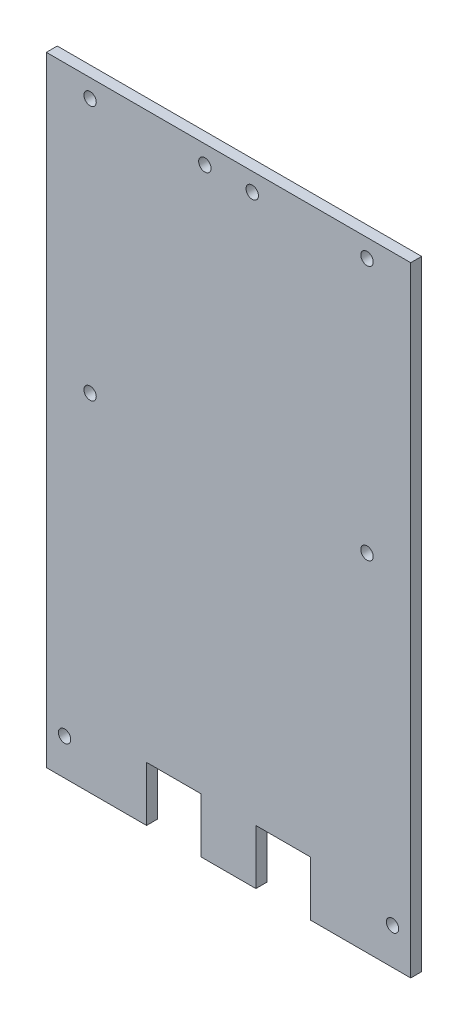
SolidWorks part; units mm, degrees
ref_plane "前视基准面" through (0, 0, 0) normal (0, 0, 1) x (1, 0, 0)
ref_plane "上视基准面" through (0, 0, 0) normal (0, 1, 0) x (1, 0, 0)
ref_plane "右视基准面" through (0, 0, 0) normal (1, 0, 0) x (0, 0, -1)
sketch "草图1" plane through (0, 0, 0) normal (0, 0, 1) x (1, 0, 0)
  line L1 (-50, 85) -> (50, 85)
  line L2 (-50, 85) -> (-50, -85)
  line L3 (-50, -85) -> (50, -85)
  line L4 (50, 85) -> (50, -85)
  line L5 (-50, 85) -> (50, -85) construction
  line L6 (-50, -85) -> (50, 85) construction
  point P0 (0, 0)
  dimension "D1" = 100
  dimension "D2" = 170
extrude "凸台-拉伸1" add sketch "草图1" along normal blind 3
sketch "草图2" plane through (0, 0, 3) normal (0, 0, 1) x (1, 0, 0)
  line L0 (-50, -85) -> (50, -85) construction
  line L1 (-22.5, -100) -> (-7.5, -100)
  line L2 (-22.5, -100) -> (-22.5, -70)
  line L3 (-22.5, -70) -> (-7.5, -70)
  line L4 (-7.5, -100) -> (-7.5, -70)
  line L5 (-22.5, -100) -> (-7.5, -70) construction
  line L6 (-22.5, -70) -> (-7.5, -100) construction
  line L8 (7.5, -100) -> (22.5, -100)
  line L9 (7.5, -100) -> (7.5, -70)
  line L10 (7.5, -70) -> (22.5, -70)
  line L11 (22.5, -100) -> (22.5, -70)
  line L12 (7.5, -100) -> (22.5, -70) construction
  line L13 (7.5, -70) -> (22.5, -100) construction
  point P0 (-15, -85)
  point P7 (15, -85)
  point P12 (0, -85)
  dimension "D1" = 15
  dimension "D2" = 15
  dimension "D3" = 15
  dimension "D4" = 7.5
  dimension "D5" = 30
  dimension "D6" = 30
extrude "切除-拉伸1" cut sketch "草图2" against normal blind 3
hole_wizard "Ø3.4 (3.4) 直径孔1" positions "草图3" profile "草图4" hole size "Ø3.4" standard "GB"
sketch "草图3" plane through (0, 0, 3) normal (0, 0, 1) x (1, 0, 0)
  point P0 (-6.5, 80)
  point P3 (6.5, 80)
sketch "草图4" plane through (-6.5, 80, 3) normal (1, 0, 0) x (0, -1, 0)
  line L0 (0, 0) -> (0, 3)
  line L1 (0, 3) -> (1.7, 3)
  line L2 (1.7, 3) -> (1.7, 0)
  line L5 (1.7, 0) -> (0, 0)
  line L11 (0, -6.35) -> (0, 107.95) construction
  dimension "通孔孔直径" = 3.4
  dimension "通孔孔深度" = 3
hole_wizard "Ø3.4 (3.4) 直径孔2" positions "草图5" profile "草图6" hole size "Ø3.4" standard "GB"
sketch "草图5" plane through (0, 0, 3) normal (0, 0, 1) x (1, 0, 0)
  point P0 (-45, -75)
  point P3 (45, -75)
sketch "草图6" plane through (-45, -75, 3) normal (1, 0, 0) x (0, -1, 0)
  line L0 (0, 0) -> (0, 3)
  line L1 (0, 3) -> (1.7, 3)
  line L2 (1.7, 3) -> (1.7, 0)
  line L5 (1.7, 0) -> (0, 0)
  line L11 (0, -6.35) -> (0, 107.95) construction
  dimension "通孔孔直径" = 3.4
  dimension "通孔孔深度" = 3
hole_wizard "Ø3.4 (3.4) 直径孔3" positions "草图7" profile "草图8" hole size "Ø3.4" standard "GB"
sketch "草图7" plane through (0, 0, 3) normal (0, 0, 1) x (1, 0, 0)
  point P0 (-38, 80)
  point P3 (38, 80)
  point P6 (-38, 10)
  point P9 (38, 10)
sketch "草图8" plane through (-38, 80, 3) normal (1, 0, 0) x (0, -1, 0)
  line L0 (0, 0) -> (0, 3)
  line L1 (0, 3) -> (1.7, 3)
  line L2 (1.7, 3) -> (1.7, 0)
  line L5 (1.7, 0) -> (0, 0)
  line L11 (0, -6.35) -> (0, 107.95) construction
  dimension "通孔孔直径" = 3.4
  dimension "通孔孔深度" = 3
